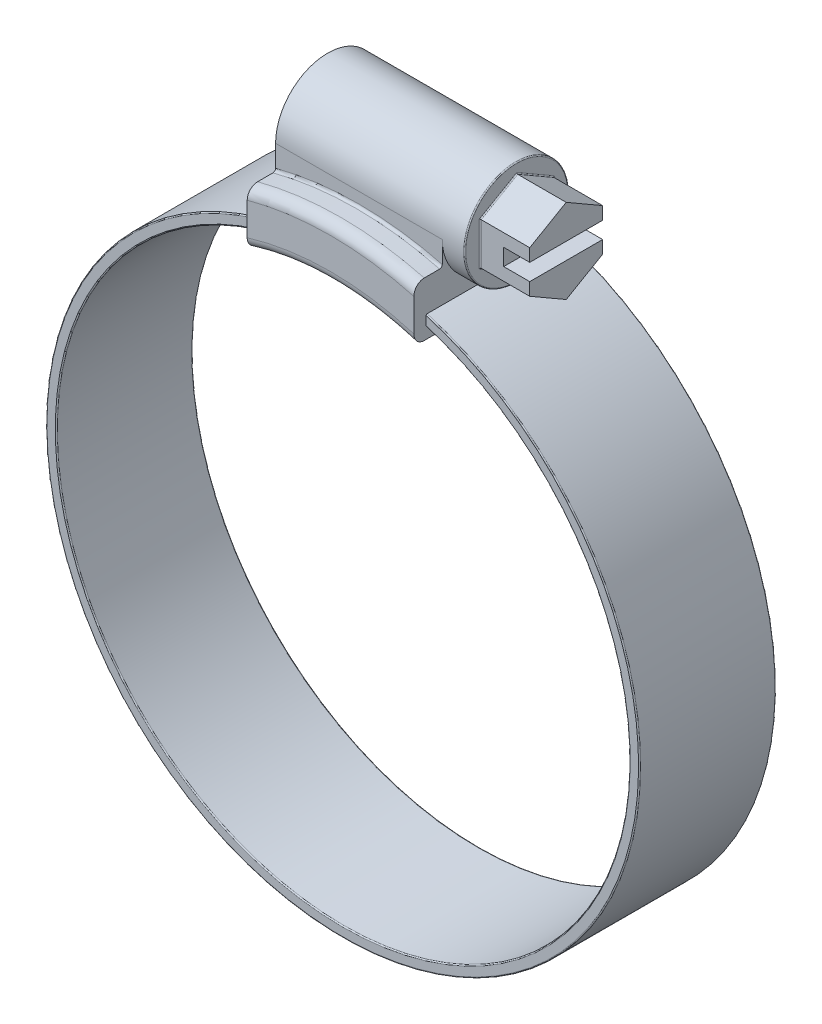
SolidWorks part; units mm, degrees
ref_plane "Front Plane" through (0, 0, 0) normal (0, 0, 1) x (1, 0, 0)
ref_plane "Top Plane" through (0, 0, 0) normal (0, 1, 0) x (1, 0, 0)
ref_plane "Right Plane" through (0, 0, 0) normal (1, 0, 0) x (0, 0, -1)
sketch "Sketch1" plane through (0, 0, 0) normal (0, 0, 1) x (1, 0, 0)
  line L0 (0, 0) -> (0, 27.5) construction
  circle A0 centre (0, 0) radius 27.5
  dimension "D1" = 55
extrude "Extrude-Thin1" add sketch "Sketch1" along normal mid plane 13.1 thin
sketch "Sketch2" plane through (0, 0, 0) normal (0, 0, 1) x (1, 0, 0)
  line L0 (-8, 0) -> (8, 0) construction
  line L1 (-8, 0) -> (-8, 30.4672) construction
  line L2 (0, 0) -> (0, 35.1201) construction
  line L3 (8, 0) -> (8, 30.4672) construction
  line L4 (-8, 30.4672) -> (-8, 25.2636)
  line L5 (8, 25.2636) -> (8, 30.4672)
  arc A0 (8, 25.2636) -> (-8, 25.2636) centre (0, 0) ccw
  arc A1 (8, 30.4672) -> (-8, 30.4672) centre (0, 0) ccw
  circle A2 centre (0, 0) radius 27.5 construction
  point P1 (0, 26.5)
  point P6 (0, 0)
  dimension "D1" = 1
  dimension "D2" = 5
  dimension "D3" = 16
extrude "Boss-Extrude1" add sketch "Sketch2" along normal mid plane 15.45
sketch "Sketch4" plane through (0, 0, 0) normal (1, 0, 0) x (0, 0, -1)
  line L0 (0, 26.5) -> (0, 37.8) construction
  line L1 (0, 37.8) -> (0, 32.8) construction
  line L2 (-5, 32.8) -> (-5, 30.4672)
  line L3 (-7.725, 30.4672) -> (7.725, 30.4672) construction
  line L4 (-5, 30.4672) -> (5, 30.4672)
  line L5 (5, 30.4672) -> (5, 32.8)
  arc A1 (5, 32.8) -> (-5, 32.8) centre (0, 32.8) ccw
  dimension "D3" = 10
  dimension "D1" = 11.3
  dimension "D2" = 5
extrude "Boss-Extrude2" add sketch "Sketch4" along normal up to surface and the other way up to surface contours A1 L2 L4 L5
sketch "Sketch6" plane through (0, 0, 0) normal (1, 0, 0) x (0, 0, -1)
  circle A0 centre (0, 32.8) radius 5
  dimension "D1" = 10
sketch "Sketch7" plane through (8, 0, 0) normal (1, 0, 0) x (0, 0, -1)
  circle A0 centre (0, 32.8) radius 5
extrude "Boss-Extrude4" add sketch "Sketch7" along normal blind 2.15
sketch "Sketch8" plane through (10.15, 0, 0) normal (1, 0, 0) x (0, 0, -1)
  line L1 (0.0005, 28.7585) -> (3.5002, 30.7797)
  line L2 (3.5002, 30.7797) -> (3.4998, 34.8211)
  line L3 (3.4998, 34.8211) -> (-0.0005, 36.8415)
  line L4 (-0.0005, 36.8415) -> (-3.5002, 34.8203)
  line L5 (-3.5002, 34.8203) -> (-3.4998, 30.7789)
  line L6 (-3.4998, 30.7789) -> (0.0005, 28.7585)
  circle A0 centre (0, 32.8) radius 3.5 construction
  dimension "D1" = 7
extrude "Boss-Extrude5" add sketch "Sketch8" along normal blind 4.75
sketch "Sketch9" plane through (14.9, 0, 0) normal (1, 0, 0) x (0, 0, -1)
  line L0 (0, 0) -> (0, 32.8) construction
  line L2 (-3.9589, 31.9996) -> (3.959, 32.0004)
  line L3 (-3.9589, 31.9996) -> (-3.959, 33.5996)
  line L4 (3.959, 32.0004) -> (3.9589, 33.6004)
  line L5 (-3.959, 33.5996) -> (3.9589, 33.6004)
  line L6 (-3.9589, 31.9996) -> (3.9589, 33.6004) construction
  line L7 (3.959, 32.0004) -> (-3.959, 33.5996) construction
  line L8 (-3.5002, 34.8203) -> (-3.4998, 30.7789) construction
  dimension "D1" = 1.6
  dimension "D2" = 7.9179
extrude "Cut-Extrude1" cut sketch "Sketch9" against normal blind 2.5
ref_plane "Plane1" through (0, 37.8, 0) normal (0, 1, 0) x (1, 0, 0)
sketch "Sketch11" plane through (0, 37.8, 0) normal (0, 1, 0) x (1, 0, 0)
  line L0 (0, 0) -> (0, -2) construction
  line L1 (-8, -2) -> (10.15, -2) construction
  line L2 (-8, 6.55) -> (-8, -6.55) construction
  line L3 (10.15, -5) -> (10.15, 5) construction
  text T0 "JUBILEE"
  dimension "D1" = 2
wrap "Wrap2" [suppressed] sketch "Sketch11" source sketch "Sketch11" thickness 0.1 parameters "D1"=0.1
fillet "Fillet1" radius 0.1 11 edges at (10.15, 32.8004, -3.5) (10.15, 29.7691, -1.7503) (10.15, 29.7687, 1.7497) (10.15, 32.7996, 3.5) (10.15, 35.8313, -1.7497) (10.15, 35.8309, 1.7503) (0, -27.5, -6.55) (0, -27.5, 6.55) (0, -28.5, -6.55) (0, -28.5, 6.55) (10.15, 32.8, -5)
fillet "Fillet2" radius 1 4 edges at (0, 26.5, 7.725) (0, 26.5, -7.725) (0, 31.5, -7.725) (0, 31.5, 7.725)
fillet "Fillet3" radius 0.25 2 edges at (0, 31.5, -5) (0, 31.5, 5)
